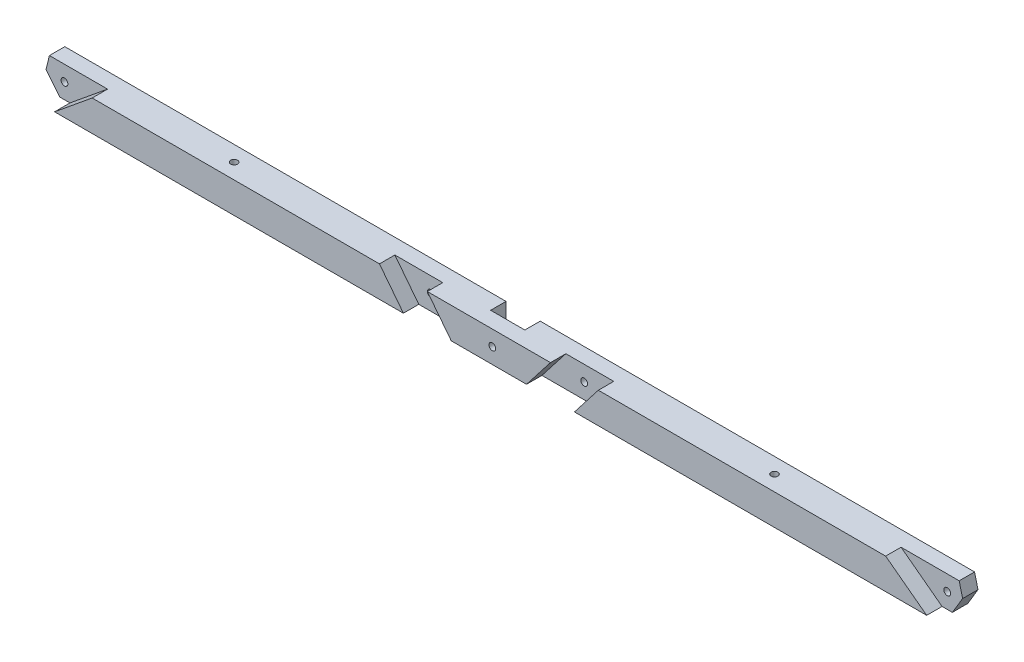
SolidWorks part; units mm, degrees
ref_plane "Plan de face" through (0, 0, 0) normal (0, 0, 1) x (1, 0, 0)
ref_plane "Plan de dessus" through (0, 0, 0) normal (0, 1, 0) x (1, 0, 0)
ref_plane "Plan de droite" through (0, 0, 0) normal (1, 0, 0) x (0, 0, -1)
sketch "Esquisse1" plane through (0, 0, 0) normal (0, 0, 1) x (1, 0, 0)
  line L1 (0, 0) -> (268, 0)
  line L2 (0, 0) -> (0, 9)
  line L3 (0, 9) -> (268, 9)
  line L4 (268, 0) -> (268, 9)
  dimension "D1" = 268
  dimension "D2" = 9
extrude "Extrusion1" add sketch "Esquisse1" along normal blind 9
sketch "Esquisse2" plane through (0, 0, 9) normal (0, 0, 1) x (1, 0, 0)
  line L0 (0, 0) -> (268, 0) construction
  line L1 (129, 0) -> (139, 0)
  line L2 (129, 0) -> (129, 9)
  line L3 (129, 9) -> (139, 9)
  line L4 (139, 0) -> (139, 9)
  point P9 (-42.4878, 70.9066)
  dimension "D1" = 10
  dimension "D2" = 129
extrude "Enlèv. mat.-Extru.1" cut sketch "Esquisse2" against normal blind 4.5
sketch "Esquisse3" plane through (0, 0, 4.5) normal (0, 0, 1) x (1, 0, 0)
  line L0 (129, 0) -> (139, 0) construction
  line L1 (129, 9) -> (129, 0) construction
  circle A0 centre (134, 4.5) radius 1
  point P4 (129, 4.5)
  dimension "D3" = 2
  dimension "D1" = 4.5
  dimension "D2" = 5
extrude "Enlèv. mat.-Extru.2" cut sketch "Esquisse3" against normal blind 4.5
sketch "Esquisse4" plane through (0, 0, 9) normal (0, 0, 1) x (1, 0, 0)
  line L0 (152, 9) -> (166, 9)
  line L1 (268, 9) -> (139, 9) construction
  line L2 (166, 9) -> (159, 0)
  line L3 (139, 0) -> (268, 0) construction
  line L4 (159, 0) -> (145, 0)
  line L5 (145, 0) -> (152, 9)
  dimension "D1" = 14
  dimension "D2" = 13
  dimension "D3" = 6
  dimension "D4" = 14
extrude "Enlèv. mat.-Extru.3" cut sketch "Esquisse4" against normal blind 4.5
sketch "Esquisse5" plane through (0, 0, 4.5) normal (0, 0, 1) x (1, 0, 0)
  line L0 (152, 9) -> (162.7361, 0) construction
  line L1 (162.7361, 0) -> (170.0874, 8.7694) construction
  line L2 (170.0874, 8.7694) -> (145, 0) construction
  line L3 (152, 9) -> (145, 0) construction
  line L4 (145, 0) -> (159, 0) construction
  circle A0 centre (157.368, 4.5) radius 1
  dimension "D3" = 2
  dimension "D1" = 7
  dimension "D2" = 4.5
extrude "Enlèv. mat.-Extru.4" cut sketch "Esquisse5" against normal blind 4.5
sketch "Esquisse6" plane through (0, 0, 9) normal (0, 0, 1) x (1, 0, 0)
  line L0 (116, 9) -> (102, 9)
  line L1 (129, 9) -> (0, 9) construction
  line L2 (102, 9) -> (109, 0)
  line L3 (0, 0) -> (129, 0) construction
  line L4 (109, 0) -> (123, 0)
  line L5 (123, 0) -> (116, 9)
  dimension "D1" = 13
  dimension "D2" = 6
  dimension "D3" = 14
  dimension "D4" = 14
extrude "Enlèv. mat.-Extru.5" cut sketch "Esquisse6" against normal blind 4.5
sketch "Esquisse7" plane through (0, 0, 4.5) normal (0, 0, 1) x (1, 0, 0)
  line L0 (109, 0) -> (123, 0) construction
  line L1 (102, 9) -> (109, 0) construction
  circle A0 centre (112.5, 4.5) radius 1
  point P4 (105.5, 4.5)
  dimension "D3" = 2
  dimension "D1" = 4.5
  dimension "D2" = 7
extrude "Enlèv. mat.-Extru.6" cut sketch "Esquisse7" against normal blind 4.5
sketch "Esquisse8" plane through (0, 0, 9) normal (0, 0, 1) x (1, 0, 0)
  line L0 (0, 0) -> (4, 0)
  line L1 (0, 0) -> (109, 0) construction
  line L2 (4, 0) -> (0, 5)
  line L3 (0, 9) -> (0, 0) construction
  line L4 (0, 5) -> (0, 0)
  dimension "D1" = 5
  dimension "D2" = 4
extrude "Enlèv. mat.-Extru.8" cut sketch "Esquisse8" against normal blind 9
sketch "Esquisse9" plane through (0, 0, 9) normal (0, 0, 1) x (1, 0, 0)
  line L0 (1, 9) -> (0, 9)
  line L1 (102, 9) -> (0, 9) construction
  line L2 (0, 9) -> (0, 5)
  line L3 (0, 5) -> (1, 9)
  dimension "D1" = 1
extrude "Enlèv. mat.-Extru.9" cut sketch "Esquisse9" against normal blind 9
sketch "Esquisse10" plane through (0, 0, 9) normal (0, 0, 1) x (1, 0, 0)
  line L0 (1, 9) -> (18, 9)
  line L1 (102, 9) -> (1, 9) construction
  line L2 (18, 9) -> (7, 0)
  line L3 (4, 0) -> (109, 0) construction
  line L4 (7, 0) -> (4, 0)
  line L5 (4, 0) -> (0, 5)
  line L6 (0, 5) -> (1, 9)
  dimension "D1" = 17
  dimension "D2" = 3
extrude "Enlèv. mat.-Extru.10" cut sketch "Esquisse10" against normal blind 4.5
sketch "Esquisse11" plane through (0, 0, 4.5) normal (0, 0, 1) x (1, 0, 0)
  line L0 (18, 9) -> (1, 9) construction
  line L1 (7, 0) -> (18, 9) construction
  circle A0 centre (5.3937, 4.5) radius 1
  dimension "D3" = 2
  dimension "D1" = 4.5
  dimension "D2" = 4.5
extrude "Enlèv. mat.-Extru.11" cut sketch "Esquisse11" against normal blind 4.5
sketch "Esquisse12" plane through (0, 0, 9) normal (0, 0, 1) x (1, 0, 0)
  line L0 (268, 0) -> (268, 5)
  line L1 (268, 0) -> (268, 9) construction
  line L2 (268, 5) -> (265, 0)
  line L3 (159, 0) -> (268, 0) construction
  line L4 (265, 0) -> (268, 0)
  dimension "D1" = 5
  dimension "D2" = 3
extrude "Enlèv. mat.-Extru.14" cut sketch "Esquisse12" against normal blind 9
sketch "Esquisse13" plane through (0, 0, 9) normal (0, 0, 1) x (1, 0, 0)
  line L0 (268, 5) -> (267, 9)
  line L1 (268, 9) -> (166, 9) construction
  line L2 (267, 9) -> (268, 9)
  line L3 (268, 9) -> (268, 5)
  dimension "D1" = 1
extrude "Enlèv. mat.-Extru.15" cut sketch "Esquisse13" against normal blind 9
sketch "Esquisse14" plane through (0, 0, 9) normal (0, 0, 1) x (1, 0, 0)
  line L0 (265, 0) -> (268, 5)
  line L1 (268, 5) -> (267, 9)
  line L2 (267, 9) -> (250, 9)
  line L3 (267, 9) -> (166, 9) construction
  line L4 (250, 9) -> (262, 0)
  line L5 (159, 0) -> (265, 0) construction
  line L6 (262, 0) -> (265, 0)
  dimension "D1" = 17
  dimension "D2" = 3
extrude "Enlèv. mat.-Extru.16" cut sketch "Esquisse14" against normal blind 4.5
sketch "Esquisse15" plane through (0, 0, 4.5) normal (0, 0, 1) x (1, 0, 0)
  line L0 (250, 9) -> (262, 0) construction
  line L1 (267, 9) -> (250, 9) construction
  circle A0 centre (263.5, 4.5) radius 1
  dimension "D3" = 2
  dimension "D1" = 4.5
  dimension "D2" = 4.5
extrude "Enlèv. mat.-Extru.17" cut sketch "Esquisse15" against normal blind 4.5
sketch "Esquisse16" plane through (0, 0, 4.5) normal (0, 0, 1) x (1, 0, 0)
  line L1 (139, 0) -> (129, 0)
  line L2 (139, 0) -> (139, 9)
  line L3 (139, 9) -> (129, 9)
  line L4 (129, 0) -> (129, 9)
  dimension "D1" = 10
extrude "Extrusion2" add sketch "Esquisse16" along normal blind 4.5
sketch "Esquisse17" plane through (0, 0, 0) normal (0, 0, -1) x (-1, 0, 0)
  line L0 (-4, 0) -> (-265, 0) construction
  line L1 (-140, 0) -> (-130, 0)
  line L2 (-140, 0) -> (-140, 9)
  line L3 (-140, 9) -> (-130, 9)
  line L4 (-130, 0) -> (-130, 9)
  line L5 (-267, 9) -> (-1, 9) construction
  dimension "D1" = 129
  dimension "D2" = 10
extrude "Enlèv. mat.-Extru.20" cut sketch "Esquisse17" against normal blind 4.5
sketch "Esquisse19" plane through (0, 0, 4.5) normal (0, 0, -1) x (-1, 0, 0)
  line L0 (-140, 0) -> (-130, 0) construction
  line L1 (-130, 0) -> (-130, 9) construction
  circle A0 centre (-135, 4.5) radius 1
  point P2 (-135, 0)
  point P5 (-130, 4.5)
  dimension "D3" = 2
  dimension "D1" = 4.5
  dimension "D2" = 5
extrude "Enlèv. mat.-Extru.21" cut sketch "Esquisse19" against normal blind 4.5
sketch "Esquisse20" plane through (0, 9, 0) normal (0, 1, 0) x (1, 0, 0)
  line L0 (102, -9) -> (18, -9) construction
  circle A0 centre (55, -4.5) radius 1
  dimension "D3" = 2
  dimension "D1" = 55
  dimension "D2" = 4.5
extrude "Enlèv. mat.-Extru.22" cut sketch "Esquisse20" against normal blind 9
sketch "Esquisse21" plane through (0, 9, 0) normal (0, 1, 0) x (1, 0, 0)
  line L0 (267, 0) -> (140, 0) construction
  circle A0 centre (213, -4.5) radius 1
  dimension "D3" = 2
  dimension "D1" = 55
  dimension "D2" = 4.5
extrude "Enlèv. mat.-Extru.23" cut sketch "Esquisse21" against normal blind 9
